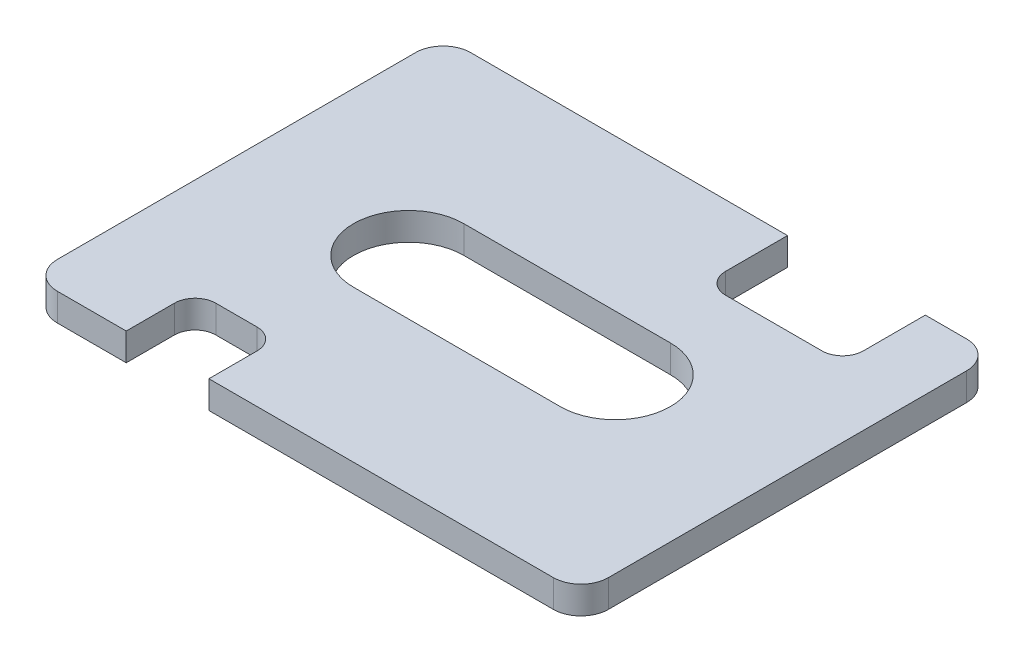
SolidWorks part; units mm, degrees
ref_plane "Front Plane" through (0, 0, 0) normal (0, 0, 1) x (1, 0, 0)
ref_plane "Top Plane" through (0, 0, 0) normal (0, 1, 0) x (1, 0, 0)
ref_plane "Right Plane" through (0, 0, 0) normal (1, 0, 0) x (0, 0, -1)
sketch "Sketch1" plane through (0, 0, 0) normal (0, 1, 0) x (1, 0, 0)
  line L1 (-100, -75) -> (100, -75)
  line L2 (-100, -75) -> (-100, 75)
  line L3 (-100, 75) -> (100, 75)
  line L4 (100, -75) -> (100, 75)
  line L5 (-100, -75) -> (100, 75) construction
  line L6 (-100, 75) -> (100, -75) construction
  point P0 (0, 0)
  dimension "D1" = 200
  dimension "D2" = 150
extrude "Boss-Extrude1" add sketch "Sketch1" along normal blind 10
sketch "Sketch2" plane through (0, 10, 0) normal (0, 1, 0) x (1, 0, 0)
  line L0 (-100, -75) -> (100, -75) construction
  line L1 (-65, -100) -> (-35, -100)
  line L2 (-65, -100) -> (-65, -50)
  line L3 (-65, -50) -> (-35, -50)
  line L4 (-35, -100) -> (-35, -50)
  line L5 (-65, -100) -> (-35, -50) construction
  line L6 (-65, -50) -> (-35, -100) construction
  line L7 (-100, 75) -> (-100, -75) construction
  point P0 (-50, -75)
  dimension "D1" = 50
  dimension "D2" = 30
  dimension "D3" = 25
extrude "Cut-Extrude1" cut sketch "Sketch2" against normal through all
sketch "Sketch3" plane through (0, 10, 0) normal (0, 1, 0) x (1, 0, 0)
  line L0 (100, 75) -> (-100, 75) construction
  line L1 (75, 105) -> (25, 105)
  line L2 (75, 105) -> (75, 45)
  line L3 (75, 45) -> (25, 45)
  line L4 (25, 105) -> (25, 45)
  line L5 (75, 105) -> (25, 45) construction
  line L6 (75, 45) -> (25, 105) construction
  line L7 (100, -75) -> (100, 75) construction
  point P0 (50, 75)
  dimension "D1" = 50
  dimension "D2" = 50
  dimension "D3" = 30
extrude "Cut-Extrude2" cut sketch "Sketch3" against normal through all
sketch "Sketch4" plane through (0, 10, 0) normal (0, 1, 0) x (1, 0, 0)
  line L0 (-37.5, 0) -> (37.5, 0) construction
  line L1 (-37.5, 20) -> (37.5, 20)
  line L2 (-37.5, -20) -> (37.5, -20)
  arc A0 (-37.5, 20) -> (-37.5, -20) centre (-37.5, 0) ccw
  arc A1 (37.5, -20) -> (37.5, 20) centre (37.5, 0) ccw
  point P2 (0, 0)
  dimension "D1" = 20
  dimension "D2" = 75
extrude "Cut-Extrude3" cut sketch "Sketch4" against normal through all
fillet "Fillet1" radius 7.5 4 edges at (75, 5, -45) (25, 5, -45) (-35, 5, 50) (-65, 5, 50)
fillet "Fillet2" radius 10 4 edges at (-100, 5, -75) (100, 5, -75) (100, 5, 75) (-100, 5, 75)
